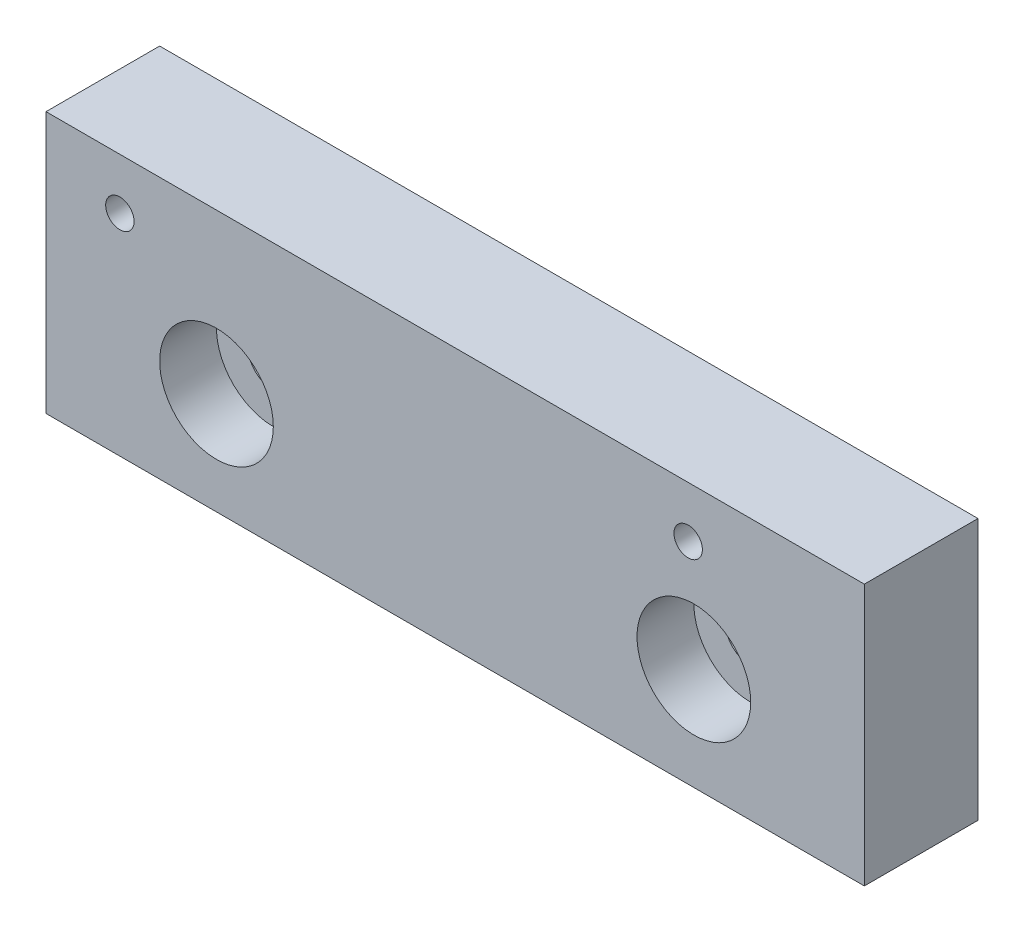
SolidWorks part; units mm, degrees
extrude "Base-Extrusion" add sketch "Esquisse1" along normal blind 10
sketch "Esquisse1" plane through (0, 0, 0) normal (0, 0, 1) x (1, 0, 0)
  line L0 (-36, 11.5) -> (36, 11.5)
  line L1 (-36, 11.5) -> (-36, -11.5)
  line L2 (36, -11.5) -> (-36, -11.5)
  line L3 (36, -11.5) -> (36, 11.5)
  line L4 (0, 35.5924) -> (0, -35.5924) construction
  line L5 (-74.0519, 0) -> (74.0519, 0) construction
  circle A0 centre (-29.5, 7) radius 1.15
  circle A1 centre (20.5, 7) radius 1.15
  circle A2 centre (-21, -2.5) radius 2.25
  circle A3 centre (21, -2.5) radius 2.25
  dimension "D3" = 2.3
  dimension "D4" = 4.5
  dimension "D5" = 6.5
  dimension "D6" = 50
  dimension "D7" = 4.5
  dimension "D8" = 14
  dimension "D9" = 42
  dimension "D10" = 15
  dimension "D1" = 72
  dimension "D2" = 23
ref_plane "Plan1" through (0, 0, 0) normal (0, 0, 1) x (1, 0, 0)
ref_plane "Plan2" through (0, 0, 0) normal (0, 1, 0) x (1, 0, 0)
ref_plane "Plan3" through (0, 0, 0) normal (1, 0, 0) x (0, 0, -1)
sketch "Esquisse2" plane through (0, 0, 10) normal (0, 0, 1) x (1, 0, 0)
  circle A0 centre (21, -2.5) radius 5
  circle A1 centre (-21, -2.5) radius 5
  circle A2 centre (21, -2.5) radius 2.25 construction
  circle A3 centre (-21, -2.5) radius 2.25 construction
  circle A4 centre (-29.5, 7) radius 1.25
  circle A5 centre (20.5, 7) radius 1.25
  circle A6 centre (-29.5, 7) radius 1.15 construction
  circle A7 centre (20.5, 7) radius 1.15 construction
  dimension "D1" = 10
  dimension "D2" = 2.5
extrude "Enlèv. mat.-Extru.1" cut sketch "Esquisse2" against normal blind 5
